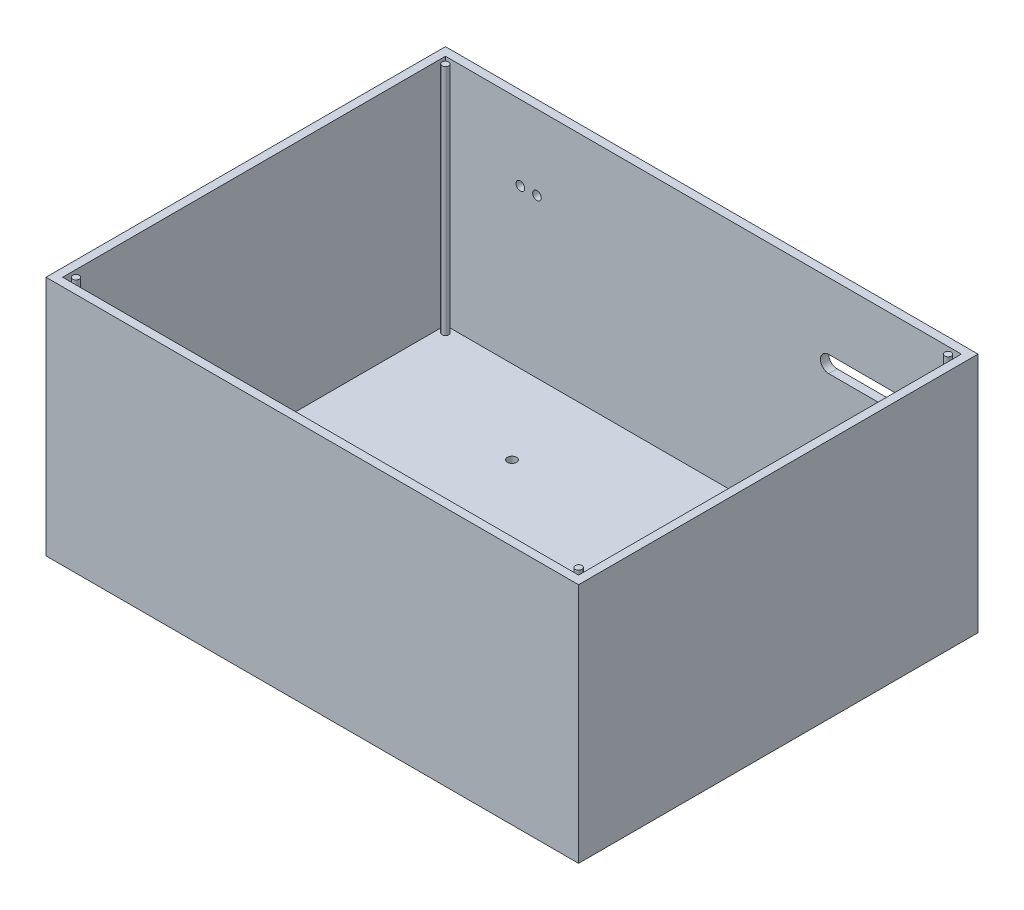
SolidWorks part; units mm, degrees
ref_plane "Front Plane" through (0, 0, 0) normal (0, 0, 1) x (1, 0, 0)
ref_plane "Top Plane" through (0, 0, 0) normal (0, 1, 0) x (1, 0, 0)
ref_plane "Right Plane" through (0, 0, 0) normal (1, 0, 0) x (0, 0, -1)
sketch "Sketch1" plane through (0, 0, 0) normal (0, 1, 0) x (1, 0, 0)
  line L0 (0, 0) -> (203.2, 0) construction
  line L1 (0, 0) -> (0, 74.983) construction
  line L3 (0, 0) -> (203.2, 0)
  line L4 (0, 0) -> (0, 152.4)
  line L5 (0, 152.4) -> (203.2, 152.4)
  line L6 (203.2, 0) -> (203.2, 152.4)
  dimension "D1" = 203.2
  dimension "D2" = 152.4
extrude "Boss-Extrude2" add sketch "Sketch1" along normal blind 3.175
sketch "Sketch2" plane through (0, 3.175, 0) normal (0, 1, 0) x (1, 0, 0)
  line L10 (0, 152.4) -> (0, 0)
  line L11 (0, 0) -> (203.2, 0)
  line L12 (203.2, 0) -> (203.2, 152.4)
  line L13 (203.2, 152.4) -> (0, 152.4)
  line L14 (3.175, 3.175) -> (200.025, 3.175)
  line L15 (200.025, 3.175) -> (200.025, 149.225)
  line L16 (200.025, 149.225) -> (3.175, 149.225)
  line L17 (3.175, 149.225) -> (3.175, 3.175)
  line L18 (3.175, 3.175) -> (200.025, 3.175)
  line L19 (200.025, 3.175) -> (200.025, 149.225)
  line L20 (200.025, 149.225) -> (3.175, 149.225)
  line L21 (3.175, 149.225) -> (3.175, 3.175)
  dimension "D1" = 3.175
extrude "Boss-Extrude3" add sketch "Sketch2" along normal blind 88.9 contours L13 L10 L11 L12 | L18 L19 L20 L21
sketch "Sketch3" plane through (0, 3.175, 0) normal (0, 1, 0) x (1, 0, 0)
  line L0 (200.025, 3.175) -> (200.025, 149.225) construction
  line L1 (3.175, 3.175) -> (200.025, 3.175) construction
  circle A0 centre (60.325, 117.475) radius 1.7145
  circle A1 centre (123.825, 117.475) radius 1.7145
  circle A2 centre (60.325, 47.625) radius 1.7145
  circle A3 centre (123.825, 47.625) radius 1.7145
  dimension "D1" = 3.429
  dimension "D2" = 3.429
  dimension "D3" = 3.429
  dimension "D4" = 3.429
  dimension "D5" = 69.85
  dimension "D6" = 63.5
  dimension "D7" = 76.2
  dimension "D8" = 44.45
  dimension "D9" = 44.45
extrude "Cut-Extrude1" cut sketch "Sketch3" against normal through all and the other way through all
sketch "Sketch4" plane through (0, 0, -152.4) normal (0, 0, -1) x (-1, 0, 0)
  line L0 (-174.625, 60.325) -> (-149.4224, 60.325)
  line L1 (-174.625, 66.675) -> (-149.4224, 66.675)
  line L2 (-203.2, 92.075) -> (-203.2, 0) construction
  line L3 (-203.2, 92.075) -> (0, 92.075) construction
  line L4 (0, 92.075) -> (0, 0) construction
  arc A0 (-174.625, 66.675) -> (-174.625, 60.325) centre (-174.625, 63.5) ccw
  arc A1 (-149.4224, 60.325) -> (-149.4224, 66.675) centre (-149.4224, 63.5) ccw
  circle A2 centre (-38.1, 63.5) radius 1.651
  circle A3 centre (-31.75, 63.5) radius 1.651
  point P1 (-177.8, 63.5)
  dimension "D1" = 6.35
  dimension "D2" = 6.35
  dimension "D5" = 3.302
  dimension "D6" = 3.302
  dimension "D3" = 25.4
  dimension "D4" = 25.4
  dimension "D7" = 31.75
  dimension "D8" = 6.35
extrude "Cut-Extrude2" cut sketch "Sketch4" against normal up to next
sketch "Sketch5" plane through (0, 3.175, 0) normal (0, 1, 0) x (1, 0, 0)
  line L0 (101.6, 0) -> (101.6, 157.015) construction
  line L1 (0, 0) -> (203.2, 0) construction
  line L2 (3.175, 3.175) -> (200.025, 3.175) construction
  line L3 (3.175, 149.225) -> (3.175, 3.175) construction
  line L4 (200.025, 149.225) -> (3.175, 149.225) construction
  circle A0 centre (5.715, 5.715) radius 1.27
  circle A1 centre (5.715, 146.685) radius 1.27
  circle A2 centre (197.485, 5.715) radius 1.27
  circle A3 centre (197.485, 146.685) radius 1.27
  dimension "D1" = 2.54
  dimension "D2" = 2.54
  dimension "D3" = 2.54
  dimension "D4" = 2.54
  dimension "D5" = 2.54
extrude "Boss-Extrude4" add sketch "Sketch5" along normal up to surface (88.9 mm away)
